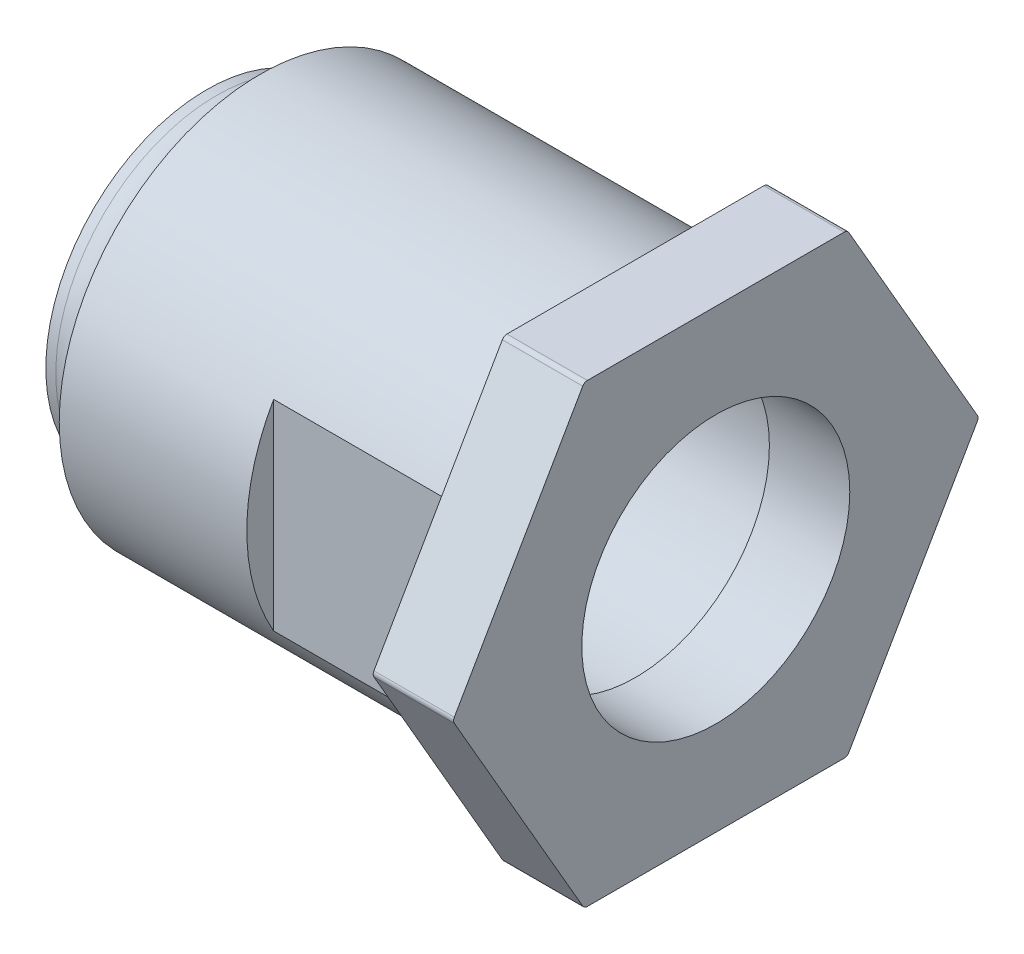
SolidWorks part; units mm, degrees
ref_plane "Front Plane" through (0, 0, 0) normal (0, 0, 1) x (1, 0, 0)
ref_plane "Top Plane" through (0, 0, 0) normal (0, 1, 0) x (1, 0, 0)
ref_plane "Right Plane" through (0, 0, 0) normal (1, 0, 0) x (0, 0, -1)
sketch "Sketch1" plane through (0, 0, 0) normal (0, 0, 1) x (1, 0, 0)
  line L0 (0, 0) -> (-17.6522, 0) construction
  line L1 (0, 7.5) -> (0, 5.5)
  line L2 (0, 5.5) -> (-16, 5.5)
  line L3 (-16, 5.5) -> (-16, 6)
  line L4 (-16, 6) -> (-15.6295, 6)
  line L5 (-14, 7.5) -> (0, 7.5)
  arc A0 (-15.6295, 6) -> (-14, 7.5) centre (-15.5051, 7.5) ccw
  dimension "D1" = 14
  dimension "D2" = 0.5
  dimension "D3" = 16
  dimension "D4" = 5.5
  dimension "D5" = 7.5
revolve "Revolve1" add sketch "Sketch1" angle 360 about L0
sketch "Sketch3" plane through (0, 0, 0) normal (1, 0, 0) x (0, 0, -1)
  line L1 (-6.5, 8.5) -> (6.5, 8.5)
  line L2 (-6.5, 8.5) -> (-6.5, -8.5)
  line L3 (-6.5, -8.5) -> (6.5, -8.5)
  line L4 (6.5, 8.5) -> (6.5, -8.5)
  line L5 (-6.5, 8.5) -> (6.5, -8.5) construction
  line L6 (-6.5, -8.5) -> (6.5, 8.5) construction
  point P0 (3.9549, -7.3549)
  point P6 (0, 0)
  dimension "D1" = 13
  dimension "D2" = 17
extrude "Cut-Extrude1" cut sketch "Sketch3" against normal blind 7 flip side to cut
sketch "Sketch4" plane through (0, 0, 0) normal (1, 0, 0) x (0, 0, -1)
  line L1 (4.9075, 8.5) -> (-4.9075, 8.5)
  line L2 (-4.9075, 8.5) -> (-9.815, 0)
  line L3 (-9.815, 0) -> (-4.9075, -8.5)
  line L4 (-4.9075, -8.5) -> (4.9075, -8.5)
  line L5 (4.9075, -8.5) -> (9.815, 0)
  line L6 (9.815, 0) -> (4.9075, 8.5)
  circle A0 centre (0, 0) radius 5
  circle A1 centre (0, 0) radius 8.5 construction
  dimension "D1" = 10
  dimension "D2" = 17
extrude "Boss-Extrude1" add sketch "Sketch4" along normal blind 3
fillet "Fillet1" radius 0.2 6 edges at (1.5, 0, 9.815) (1.5, -8.5, 4.9075) (1.5, -8.5, -4.9075) (1.5, 8.5, 4.9075) (1.5, 0, -9.815) (1.5, 8.5, -4.9075)
